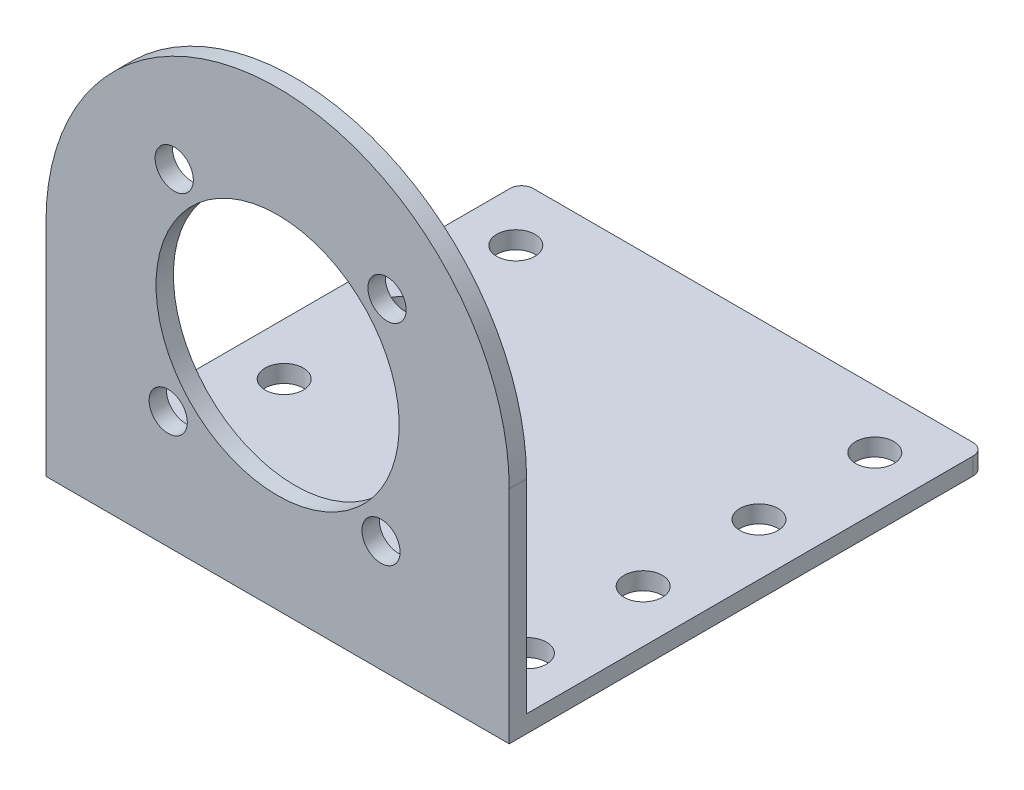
SolidWorks part; units mm, degrees
ref_plane "Front Plane" through (0, 0, 0) normal (0, 0, 1) x (1, 0, 0)
ref_plane "Top Plane" through (0, 0, 0) normal (0, 1, 0) x (1, 0, 0)
ref_plane "Right Plane" through (0, 0, 0) normal (1, 0, 0) x (0, 0, -1)
sketch "Sketch2" plane through (0, 0, 0) normal (1, 0, 0) x (0, 0, -1)
  line L1 (-36.8894, 36.5355) -> (-35.3894, 36.5355)
  line L2 (-36.8894, 36.5355) -> (-36.8894, -2.5345)
  line L3 (-36.8894, -2.5345) -> (-35.3894, -2.5345)
  line L4 (-35.3894, 36.5355) -> (-35.3894, -2.5345)
  line L5 (-36.8894, -2.5345) -> (4.1796, -2.5345)
  line L6 (-36.8894, -2.5345) -> (-36.8894, -1.0345)
  line L7 (-36.8894, -1.0345) -> (4.1796, -1.0345)
  line L8 (4.1796, -2.5345) -> (4.1796, -1.0345)
  dimension "D1" = 1.5
  dimension "D2" = 1.5
  dimension "D3" = 39.07
  dimension "D4" = 41.069
extrude "Boss-Extrude1" add sketch "Sketch2" along normal blind 40 contours L3 L4 L1 L2 | L5 L8 L7 L6
sketch "Sketch3" plane through (0, -1.0345, 0) normal (0, 1, 0) x (1, 0, 0)
  line L0 (40, 4.1796) -> (0, 4.1796) construction
  line L1 (0, -35.3894) -> (0, 4.1796) construction
  line L2 (40, -35.3894) -> (40, 4.1796) construction
  circle A0 centre (4.5, -30.8204) radius 1.65
  circle A1 centre (4.5, -20.8204) radius 1.65
  circle A2 centre (4.5, -10.8204) radius 1.65
  circle A3 centre (4.5, -0.8204) radius 1.65
  circle A4 centre (35.5, -30.8204) radius 1.65
  circle A5 centre (35.5, -20.8204) radius 1.65
  circle A6 centre (35.5, -10.8204) radius 1.65
  circle A7 centre (35.5, -0.8204) radius 1.65
  dimension "D1" = 3.3
  dimension "D2" = 5
  dimension "D3" = 10
  dimension "D4" = 10
  dimension "D5" = 10
  dimension "D6" = 5
  dimension "D7" = 10
  dimension "D8" = 10
  dimension "D9" = 30
  dimension "D10" = 4.5
  dimension "D11" = 4.5
  dimension "D12" = 4.5
  dimension "D13" = 4.5
  dimension "D14" = 4.5
  dimension "D15" = 4.5
extrude "Cut-Extrude1" cut sketch "Sketch3" against normal blind 40
sketch "Sketch4" plane through (0, 0, 35.3894) normal (0, 0, -1) x (-1, 0, 0)
  circle A0 centre (-20, 16.5355) radius 10.5
  circle A1 centre (-20, 16.5355) radius 13
  circle A2 centre (-29.4484, 25.4645) radius 1.65
  circle A3 centre (-10.5516, 7.6065) radius 1.65
  circle A4 centre (-28.929, 7.0871) radius 1.65
  circle A5 centre (-11.071, 25.984) radius 1.65
  arc A6 (-40, 16.5355) -> (0, 16.5355) centre (-20, 16.5355) cw
  dimension "D1" = 21
  dimension "D4" = 26
  dimension "D5" = 3.3
  dimension "D9" = 20
  dimension "D2" = 19.07
  dimension "D3" = 20
  dimension "D6" = 90
  dimension "D7" = 90
  dimension "D8" = 90
  dimension "D10" = 40
extrude "Cut-Extrude2" cut sketch "Sketch4" against normal blind 40 contours A0 | A1 A4 | A1 A4 | A1 A3 | A1 A3 | A6 M4 M3 | A6 M3 M2 | A1 A5 | A1 A5 | A1 A2 | A1 A2
fillet "Fillet1" radius 1 2 edges at (0, -1.7845, -4.1796) (40, -1.7845, -4.1796)
